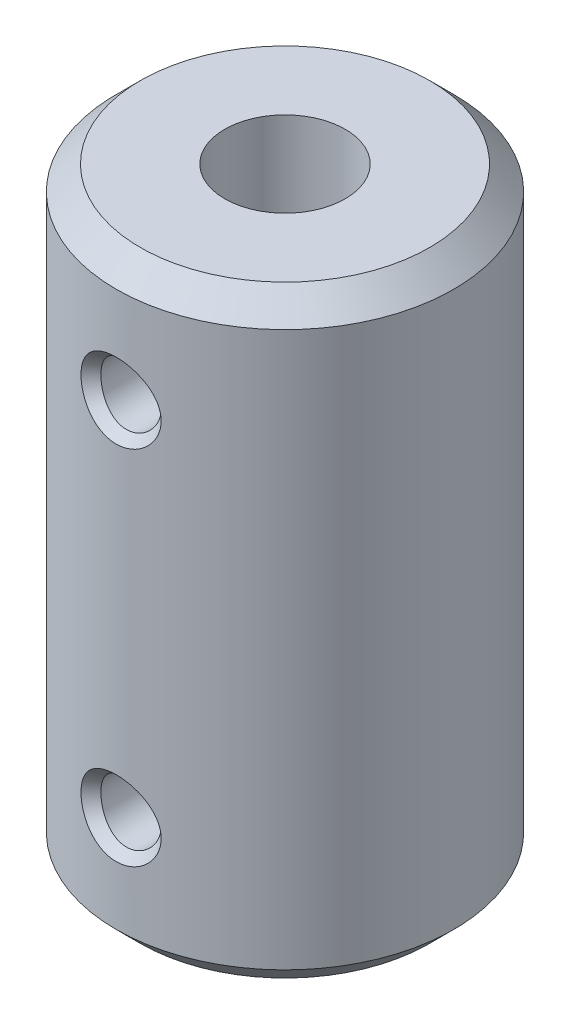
SolidWorks part; units mm, degrees
ref_plane "Спереди" through (0, 0, 0) normal (0, 0, 1) x (1, 0, 0)
ref_plane "Сверху" through (0, 0, 0) normal (0, 1, 0) x (1, 0, 0)
ref_plane "Справа" through (0, 0, 0) normal (1, 0, 0) x (0, 0, -1)
sketch "Эскиз1" plane through (0, 0, 0) normal (0, 0, 1) x (1, 0, 0)
  line L0 (0, 48.9493) -> (0, 0) construction
  line L1 (0, 0) -> (45.2432, 0) construction
  line L2 (4, 0) -> (4, 12)
  line L3 (4, 12) -> (2.5, 12)
  line L4 (2.5, 12) -> (2.5, 25)
  line L5 (2.5, 25) -> (7, 25)
  line L6 (7, 25) -> (7, 0)
  line L7 (7, 0) -> (4, 0)
  dimension "D1" = 5
  dimension "D2" = 8
  dimension "D3" = 25
  dimension "D4" = 14
  dimension "D5" = 12
revolve "Повернуть1" add sketch "Эскиз1" angle 360 about L0
chamfer "Фаска1" distance 1 angle 45 2 edges at (0, 0, 7) (0, 25, 7)
chamfer "Фаска2" distance 1 angle 45 1 edges at (0, 12, 4)
hole_wizard "Отверстие обработанное метчиком M31" positions "Эскиз3" profile "Эскиз4" tap size "M3" standard "DIN"
sketch "Эскиз3" plane through (0, 0, 0) normal (0, 0, 1) x (1, 0, 0)
  line L0 (0, 0) -> (0, 25) construction
  line L1 (-6, 0) -> (6, 0) construction
  line L2 (2.5, 25) -> (-2.5, 25) construction
  point P0 (0, 20)
  point P2 (0, 5)
  dimension "D1" = 5
  dimension "D2" = 5
sketch "Эскиз4" plane through (0, 20, 0) normal (1, 0, 0) x (0, 1, 0)
  line L0 (0, 0) -> (0, 7)
  line L1 (0, 7) -> (1.25, 7)
  line L2 (1.25, 7) -> (1.25, 0)
  line L5 (1.25, 0) -> (0, 0)
  line L11 (0, -6.35) -> (0, 107.95) construction
  dimension "Диаметр проходного сверла" = 2.5
  dimension "Глубина проходного сверла" = 7
mirror "Зеркальное отражение1" about plane through (0, 0, 0) normal (0, 0, 1) of "Отверстие обработанное метчиком M31"
chamfer "Фаска3" distance 0.5 angle 45 4 edges at (0.2653, 3.7785, -6.995) (0.2653, 18.7785, -6.995) (0.2653, 6.2215, 6.995) (0.2653, 21.2215, 6.995)
